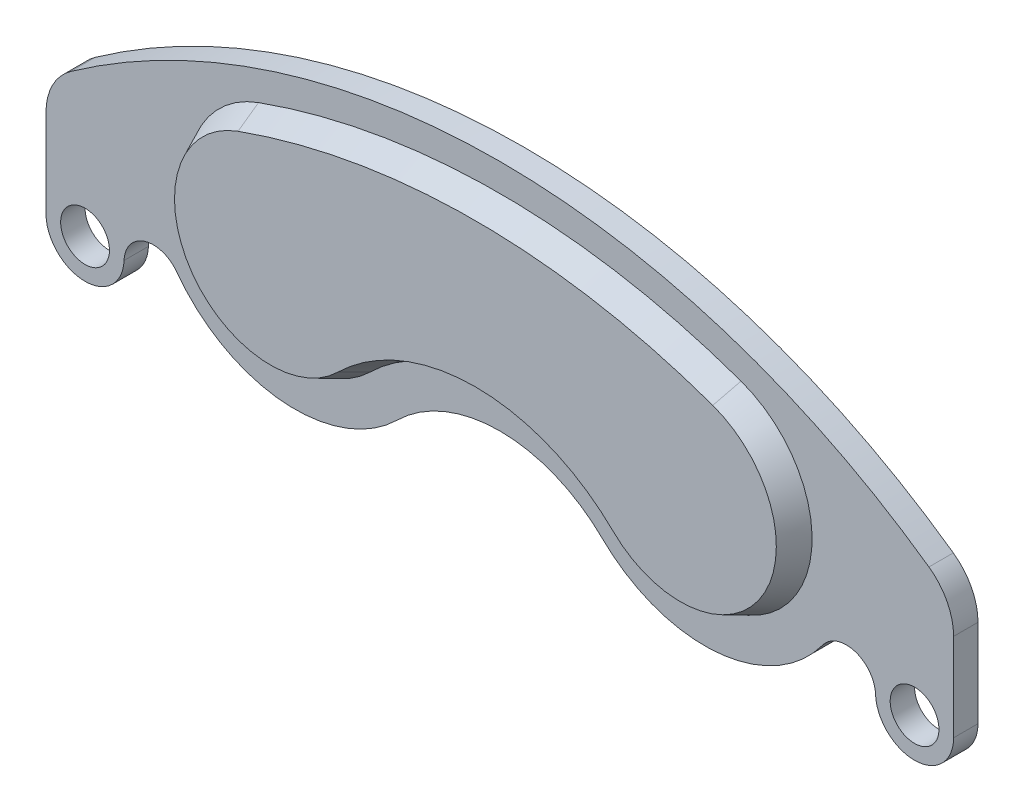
SolidWorks part; units mm, degrees
ref_plane "Front Plane" through (0, 0, 0) normal (0, 0, 1) x (1, 0, 0)
ref_plane "Top Plane" through (0, 0, 0) normal (0, 1, 0) x (1, 0, 0)
ref_plane "Right Plane" through (0, 0, 0) normal (1, 0, 0) x (0, 0, -1)
sketch "Sketch2" plane through (0, 0, 0) normal (0, 0, 1) x (1, 0, 0)
  line L0 (-121.8391, 0) -> (122.8185, 0) construction
  line L1 (0, 71.5952) -> (0, -52.9863) construction
  line L2 (46.5, 11.0185) -> (46.5, 20.0185)
  line L3 (-46.5, 11.0185) -> (-46.5, 20.0185)
  arc A0 (-10.5, 10.7121) -> (10.5, 10.7121) centre (0, 0) cw
  arc A1 (10.5, 10.7121) -> (33.0872, 12.5417) centre (21, 21.4243) ccw
  arc A2 (-10.5, 10.7121) -> (-33.0872, 12.5417) centre (-21, 21.4243) cw
  arc A3 (33.0872, 12.5417) -> (38.5026, 10.8737) centre (35.5046, 10.7652) cw
  arc A4 (-33.0872, 12.5417) -> (-38.5026, 10.8737) centre (-35.5046, 10.7652) ccw
  arc A5 (38.5026, 10.8737) -> (46.5, 11.0185) centre (42.5, 11.0185) ccw
  arc A6 (-38.5026, 10.8737) -> (-46.5, 11.0185) centre (-42.5, 11.0185) cw
  arc A7 (46.5, 20.0185) -> (43.9714, 24.9123) centre (40.5, 20.0185) ccw
  arc A8 (-46.5, 20.0185) -> (-43.9714, 24.9123) centre (-40.5, 20.0185) cw
  arc A9 (43.9714, 24.9123) -> (0, 38.9243) centre (0, -37.0757) ccw
  arc A10 (-43.9714, 24.9123) -> (0, 38.9243) centre (0, -37.0757) cw
  circle A11 centre (-42.5, 11.0185) radius 2.5
  circle A12 centre (42.5, 11.0185) radius 2.5
  dimension "D1" = 15
  dimension "D2" = 15
  dimension "D3" = 3
  dimension "D4" = 4
  dimension "D5" = 6
  dimension "D6" = 76
  dimension "D11" = 5
  dimension "D7" = 85
  dimension "D8" = 42
  dimension "D9" = 9
  dimension "D10" = 58.5
extrude "Boss-Extrude1" add sketch "Sketch2" along normal mid plane 2.5
sketch "Sketch3" plane through (0, 0, 1.25) normal (0, 0, 1) x (1, 0, 0)
  arc A0 (-13.3, 13.5687) -> (13.3, 13.5687) centre (0, 0) cw
  arc A1 (13.3, 13.5687) -> (24.7165, 31.7774) centre (21, 21.4243) ccw
  arc A2 (24.7165, 31.7774) -> (-24.7165, 31.7774) centre (0, -37.0757) ccw
  arc A3 (-24.7165, 31.7774) -> (-13.3, 13.5687) centre (-21, 21.4243) ccw
  arc A4 (-33.0872, 12.5417) -> (-10.5, 10.7121) centre (-21, 21.4243) ccw construction
  arc A5 (10.5, 10.7121) -> (-10.5, 10.7121) centre (0, 0) ccw construction
  arc A6 (10.5, 10.7121) -> (33.0872, 12.5417) centre (21, 21.4243) ccw construction
  arc A10 (43.9714, 24.9123) -> (-43.9714, 24.9123) centre (0, -37.0757) ccw construction
  dimension "D1" = 11
  dimension "D2" = 73.155
extrude "Boss-Extrude2" add sketch "Sketch3" along normal blind 2.5 draft 25
